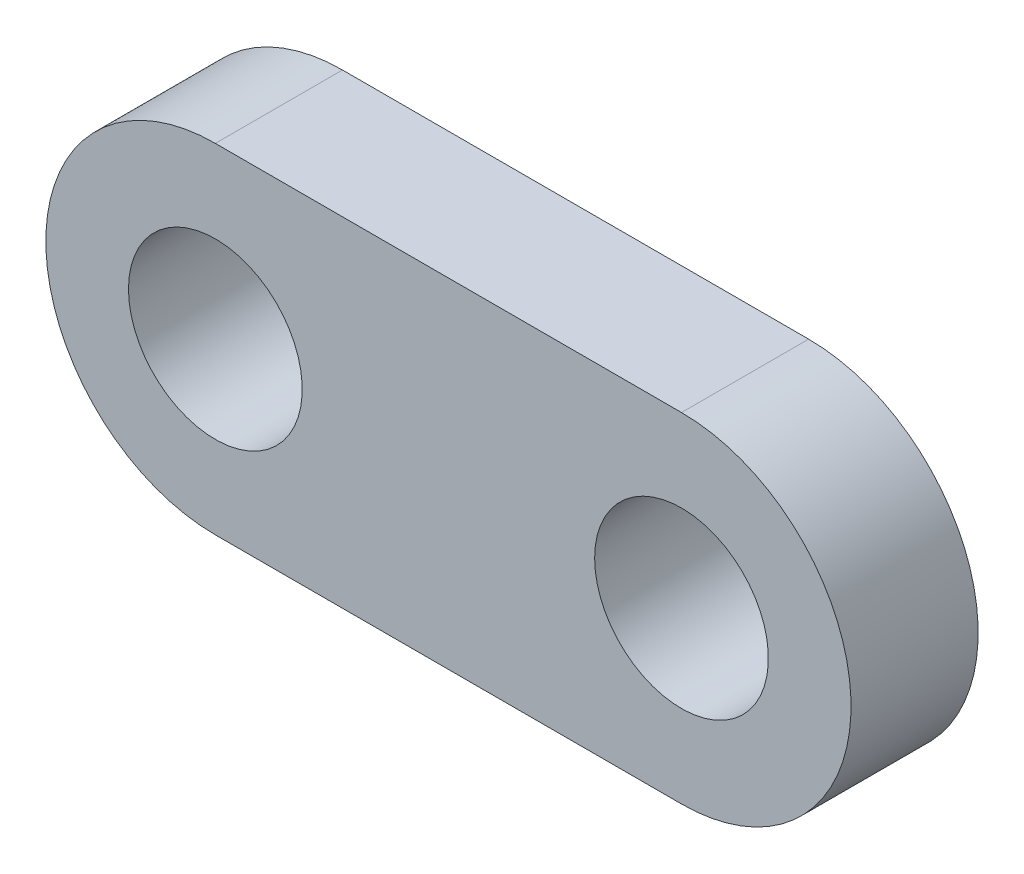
SolidWorks part; units mm, degrees
ref_plane "Plan de face" through (0, 0, 0) normal (0, 0, 1) x (1, 0, 0)
ref_plane "Plan de dessus" through (0, 0, 0) normal (0, 1, 0) x (1, 0, 0)
ref_plane "Plan de droite" through (0, 0, 0) normal (1, 0, 0) x (0, 0, -1)
ref_plane "Plan1" through (0, 0, 6) normal (0, 0, 1) x (1, 0, 0)
sketch "Esquisse1" plane through (0, 0, 6) normal (0, 0, 1) x (1, 0, 0)
  line L0 (22, 8) -> (0, 8)
  line L1 (0, -8) -> (22, -8)
  circle A0 centre (0, 0) radius 4.1
  circle A1 centre (22, 0) radius 4.1
  arc A2 (0, 8) -> (0, -8) centre (0, 0) ccw
  arc A3 (22, -8) -> (22, 8) centre (22, 0) ccw
extrude "Boss.-Extru.1" add sketch "Esquisse1" against normal blind 6
